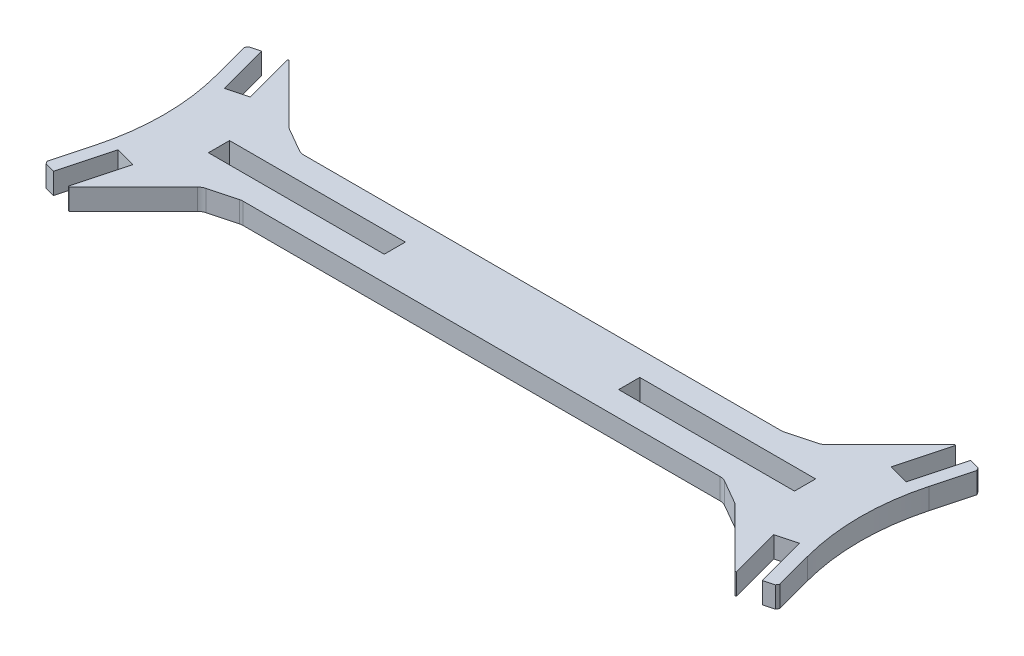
SolidWorks part; units mm, degrees
ref_plane "Alzado" through (0, 0, 0) normal (0, 0, 1) x (1, 0, 0)
ref_plane "Planta" through (0, 0, 0) normal (0, 1, 0) x (1, 0, 0)
ref_plane "Vista lateral" through (0, 0, 0) normal (1, 0, 0) x (0, 0, -1)
sketch "Croquis1" plane through (0, 0, 0) normal (0, 1, 0) x (1, 0, 0)
  line L1 (0, 0) -> (580, 0)
  line L2 (0, 0) -> (0, 60)
  line L3 (0, 60) -> (580, 60)
  line L4 (580, 0) -> (580, 60)
  dimension "D1" = 580
  dimension "D2" = 60
extrude "Saliente-Extruir1" add sketch "Croquis1" along normal blind 18
sketch "Croquis2" plane through (0, 18, 0) normal (0, 1, 0) x (1, 0, 0)
  line L0 (0, 60) -> (0, 0) construction
  line L1 (40, 39) -> (190, 39)
  line L2 (40, 39) -> (40, 21)
  line L3 (40, 21) -> (190, 21)
  line L4 (190, 39) -> (190, 21)
  line L5 (390, 39) -> (540, 39)
  line L6 (390, 39) -> (390, 21)
  line L7 (390, 21) -> (540, 21)
  line L8 (540, 39) -> (540, 21)
  line L10 (40, 30) -> (0, 30) construction
  line L11 (390, 30) -> (190, 30) construction
  line L12 (290, 30) -> (290, 0) construction
  line L13 (0, 0) -> (580, 0) construction
  dimension "D1" = 200
  dimension "D3" = 150
  dimension "D4" = 150
  dimension "D5" = 18
extrude "Cortar-Extruir1" cut sketch "Croquis2" against normal through all
sketch "Croquis3" plane through (0, 0, 0) normal (0, -1, 0) x (-1, 0, 0)
  line L0 (-290, 0) -> (-290, 60) construction
  line L1 (0, 0) -> (-580, 0) construction
  line L2 (-580, 60) -> (0, 60) construction
  line L4 (0, 0) -> (151.6252, -565.8731) construction
  line L5 (-580, 30) -> (0, 30) construction
  line L6 (-580, 0) -> (-580, 60) construction
  line L7 (0, 60) -> (0, 0) construction
  line L8 (0, 30) -> (23.0291, -55.9459)
  line L9 (23.0291, -55.9459) -> (-5.9486, -63.7105)
  line L10 (-5.9486, -63.7105) -> (-69.6591, 0)
  line L11 (-69.6591, 0) -> (0, 0)
  line L12 (0, 0) -> (0, 60)
  line L13 (-580, 0) -> (-580, 60)
  line L14 (-510.3409, 0) -> (-580, 0)
  line L15 (-574.0514, -63.7105) -> (-510.3409, 0)
  line L16 (-603.0291, -55.9459) -> (-574.0514, -63.7105)
  line L17 (-580, 30) -> (-603.0291, -55.9459)
  line L18 (-580, 30) -> (-603.0291, 115.9459)
  line L19 (-603.0291, 115.9459) -> (-574.0514, 123.7105)
  line L20 (-574.0514, 123.7105) -> (-510.3409, 60)
  line L21 (-510.3409, 60) -> (-580, 60)
  line L22 (-69.6591, 60) -> (0, 60)
  line L23 (-5.9486, 123.7105) -> (-69.6591, 60)
  line L24 (23.0291, 115.9459) -> (-5.9486, 123.7105)
  line L25 (0, 30) -> (23.0291, 115.9459)
  dimension "D1" = 30
  dimension "D2" = 45
  dimension "D3" = 60
  dimension "D4" = 75
extrude "Saliente-Extruir2" add sketch "Croquis3" against normal up to surface (18 mm away) contours L25 L24 L23 M13 M14 | L20 L19 L18 M15 M14 | L13 L17 L16 L15 M16 | L10 L9 L8 M13 M16
fillet "Redondeo1" radius 200 2 edges at (0, 9, -30) (580, 9, -30)
sketch "Croquis4" plane through (0, 0, 0) normal (0, -1, 0) x (-1, 0, 0)
  line L0 (12.404, -58.7929) -> (0.7571, -15.3263)
  line L1 (23.0291, -55.9459) -> (-5.9486, -63.7105) construction
  line L2 (0.7571, -15.3263) -> (-16.6296, -19.985)
  line L3 (-16.6296, -19.985) -> (-4.9827, -63.4517)
  line L4 (-4.9827, -63.4517) -> (12.404, -58.7929)
  line L5 (-7.9362, -17.6556) -> (3.7106, -61.1223) construction
  line L6 (13.8701, -21.7638) -> (23.0291, -55.9459) construction
  line L7 (7.0552, 30) -> (-587.0552, 30) construction
  line L8 (0.7571, -15.3263) -> (12.404, -58.7929)
  line L9 (-69.6591, 0) -> (-510.3409, 0) construction
  line L10 (-290, 0) -> (-290, 60) construction
  line L11 (-510.3409, 60) -> (-69.6591, 60) construction
  line L12 (-4.9827, -63.4517) -> (-16.6296, -19.985)
  line L13 (-572.0638, -17.6556) -> (-583.7106, -61.1223) construction
  line L14 (-575.0173, -63.4517) -> (-563.3704, -19.985)
  line L15 (-580.7571, -15.3263) -> (-592.404, -58.7929)
  line L16 (-575.0173, -63.4517) -> (-592.404, -58.7929)
  line L17 (-563.3704, -19.985) -> (-575.0173, -63.4517)
  line L18 (-580.7571, -15.3263) -> (-563.3704, -19.985)
  line L19 (-592.404, -58.7929) -> (-580.7571, -15.3263)
  line L20 (-572.0638, 77.6556) -> (-583.7106, 121.1223) construction
  line L21 (-7.9362, 77.6556) -> (3.7106, 121.1223) construction
  line L22 (-592.404, 118.7929) -> (-580.7571, 75.3263)
  line L23 (-580.7571, 75.3263) -> (-563.3704, 79.985)
  line L24 (-563.3704, 79.985) -> (-575.0173, 123.4517)
  line L25 (-575.0173, 123.4517) -> (-592.404, 118.7929)
  line L26 (-580.7571, 75.3263) -> (-592.404, 118.7929)
  line L27 (-575.0173, 123.4517) -> (-563.3704, 79.985)
  line L28 (-4.9827, 123.4517) -> (-16.6296, 79.985)
  line L29 (0.7571, 75.3263) -> (12.404, 118.7929)
  line L30 (-4.9827, 123.4517) -> (12.404, 118.7929)
  line L31 (-16.6296, 79.985) -> (-4.9827, 123.4517)
  line L32 (0.7571, 75.3263) -> (-16.6296, 79.985)
  line L33 (12.404, 118.7929) -> (0.7571, 75.3263)
  arc A0 (13.8701, 81.7638) -> (13.8701, -21.7638) centre (207.0552, 30) ccw construction
  arc A1 (-593.8701, -21.7638) -> (-593.8701, 81.7638) centre (-787.0552, 30) ccw construction
  point P42 (0, 0)
  dimension "D1" = 18
  dimension "D2" = 45
  dimension "D3" = 20
extrude "Cortar-Extruir2" cut sketch "Croquis4" against normal through all contours L2 L3 L0 M13 | L32 L29 L28 M17 | L23 L24 L22 M27 | L18 L15 L14 M31
chamfer "Chaflán1" distance 10 angle 30 4 edges at (69.6591, 9, -60) (510.3409, 9, -60) (510.3409, 9, 0) (69.6591, 9, 0)
fillet "Redondeo2" radius 10 8 edges at (55.9989, 9, -73.6603) (79.6591, 9, -60) (62.5881, 9, 7.0711) (88.9777, 9, 0) (491.0223, 9, -60) (517.4119, 9, -67.0711) (500.3409, 9, 0) (524.0011, 9, 13.6603)
chamfer "Chaflán2" distance 2 angle 45 4 edges at (603.0291, 9, -115.9459) (603.0291, 9, 55.9459) (-23.0291, 9, -115.9459) (-23.0291, 9, 55.9459)
